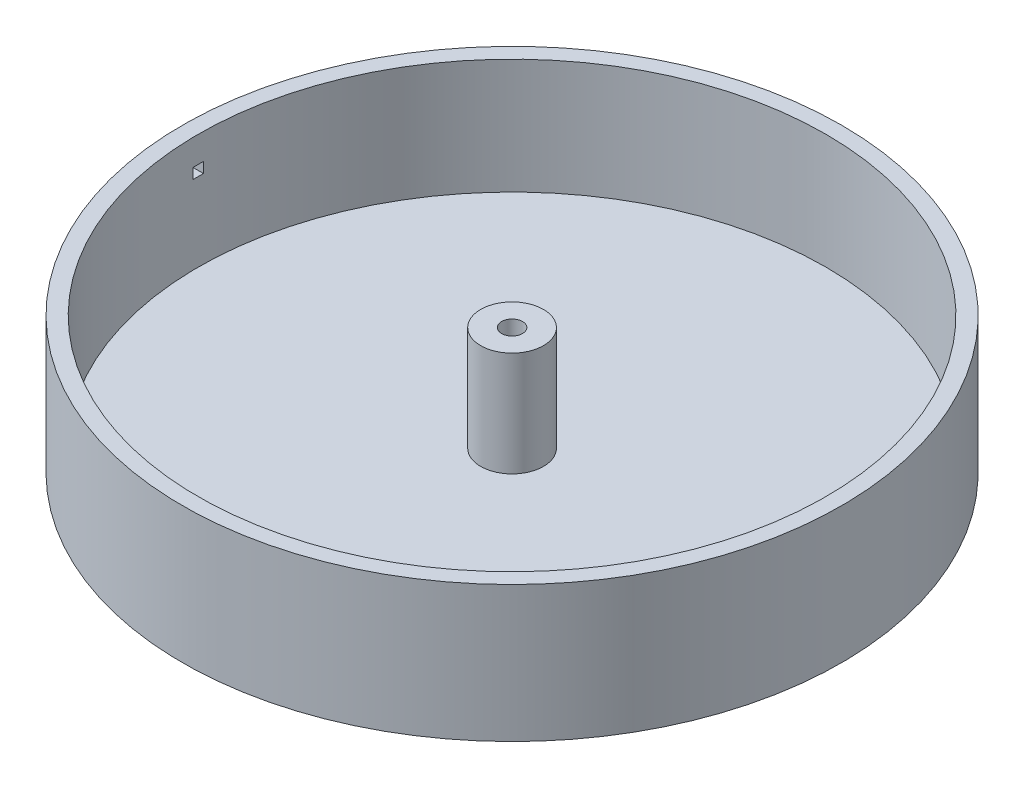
SolidWorks part; units mm, degrees
ref_plane "Front Plane" through (0, 0, 0) normal (0, 0, 1) x (1, 0, 0)
ref_plane "Top Plane" through (0, 0, 0) normal (0, 1, 0) x (1, 0, 0)
ref_plane "Right Plane" through (0, 0, 0) normal (1, 0, 0) x (0, 0, -1)
sketch "Sketch6" plane through (0, 0, 0) normal (0, 0, 1) x (1, 0, 0)
  line L0 (0, 0) -> (0, 135.0434) construction
  line L1 (-6.35, 76.2) -> (-6.35, 0)
  line L2 (-6.35, 0) -> (-200.025, 0)
  line L3 (-200.025, 0) -> (-200.025, 82.55)
  line L4 (-200.025, 82.55) -> (-190.5, 82.55)
  line L5 (-190.5, 82.55) -> (-190.5, 12.7)
  line L6 (-190.5, 12.7) -> (-19.05, 12.7)
  line L7 (-19.05, 12.7) -> (-19.05, 76.2)
  line L8 (-19.05, 76.2) -> (-6.35, 76.2)
  dimension "D1" = 381
  dimension "D2" = 9.525
  dimension "D3" = 12.7
  dimension "D4" = 38.1
  dimension "D5" = 76.2
  dimension "D6" = 69.85
  dimension "D7" = 12.7
revolve "Revolve1" add sketch "Sketch6" angle 360 about L0
sketch "Sketch2" plane through (0, 0, 0) normal (0, 1, 0) x (1, 0, 0)
  line L0 (0, 50.8) -> (-190.1822, 50.8)
  line L1 (0, -50.8) -> (-190.1822, -50.8)
  arc A0 (0, -50.8) -> (0, 50.8) centre (0, 0) ccw
  arc A1 (-190.1822, 50.8) -> (-190.1822, -50.8) centre (0, 0) ccw
  dimension "D1" = 50.8
  dimension "D2" = 196.85
sketch "Sketch5" plane through (0, 0, 0) normal (1, 0, 0) x (0, 0, -1)
  line L1 (-3.175, 66.675) -> (3.175, 66.675)
  line L2 (-3.175, 66.675) -> (-3.175, 60.325)
  line L3 (-3.175, 60.325) -> (3.175, 60.325)
  line L4 (3.175, 66.675) -> (3.175, 60.325)
  line L5 (-3.175, 66.675) -> (3.175, 60.325) construction
  line L6 (-3.175, 60.325) -> (3.175, 66.675) construction
  point P0 (0, 63.5)
  point P5 (0, 0)
  dimension "D1" = 6.35
  dimension "D2" = 6.35
  dimension "D3" = 63.5
extrude "Cut-Extrude1" cut sketch "Sketch5" against normal through all from offset 50.8
